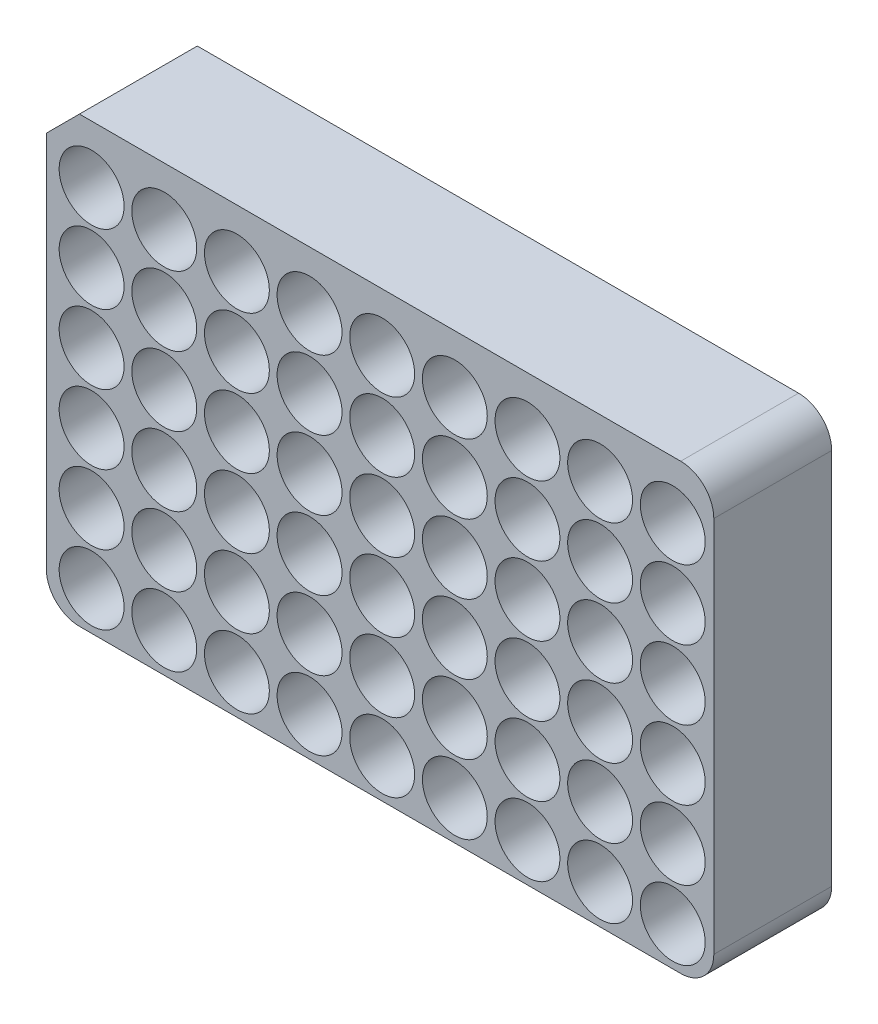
SolidWorks part; units mm, degrees
ref_plane "Front Plane" through (0, 0, 0) normal (0, 0, 1) x (1, 0, 0)
ref_plane "Top Plane" through (0, 0, 0) normal (0, 1, 0) x (1, 0, 0)
ref_plane "Right Plane" through (0, 0, 0) normal (1, 0, 0) x (0, 0, -1)
sketch "Sketch1" plane through (0, 0, 0) normal (0, 0, 1) x (1, 0, 0)
  line L1 (-64.008, 42.545) -> (64.008, 42.545)
  line L2 (-64.008, 42.545) -> (-64.008, -42.545)
  line L3 (-64.008, -42.545) -> (64.008, -42.545)
  line L4 (64.008, 42.545) -> (64.008, -42.545)
  dimension "D1" = 128.016
  dimension "D2" = 85.09
  dimension "D3" = 42.545
  dimension "D4" = 64.008
extrude "Boss-Extrude1" add sketch "Sketch1" along normal blind 22.606
fillet "Fillet1" radius 6.35 3 edges at (64.008, -42.545, 11.303) (64.008, 42.545, 11.303) (-64.008, -42.545, 11.303)
sketch "Sketch2" plane through (0, 0, 22.606) normal (0, 0, 1) x (1, 0, 0)
  line L0 (-64.008, 42.545) -> (-64.008, -36.195) construction
  line L1 (57.658, 42.545) -> (-64.008, 42.545) construction
  circle A0 centre (-55.3212, 31.496) radius 6.223
  dimension "D1" = 12.446
  dimension "D2" = 8.6868
  dimension "D3" = 11.049
extrude "Cut-Extrude1" cut sketch "Sketch2" against normal blind 20.32
pattern_linear "LPattern1" count 9 spacing 13.9319 along (1, 0, 0) count 6 spacing 13.3096 along (0, -1, 0) of "Cut-Extrude1"
chamfer "Chamfer1" distance 6.35 angle 45 1 edges at (-64.008, 42.545, 11.303)
equation "\"D3@Sketch1\"=\"D2@Sketch1\"/2"
equation "\"D4@Sketch1\"=\"D1@Sketch1\"/2"
